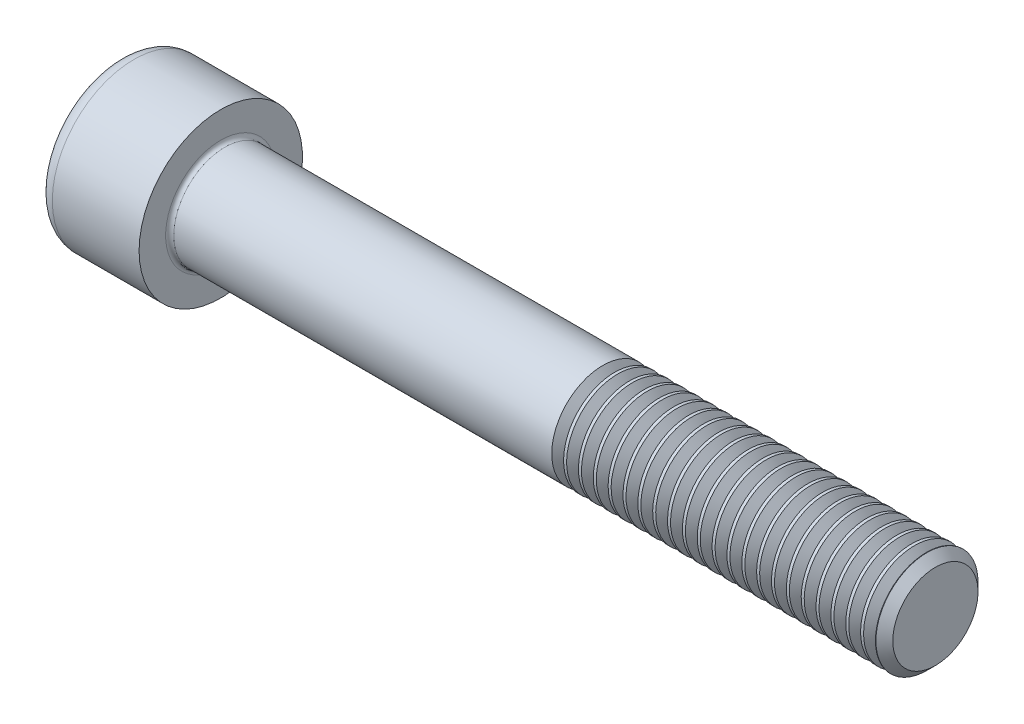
SolidWorks part; units mm, degrees
ref_plane "Plane1" through (0, 0, 0) normal (0, 0, 1) x (1, 0, 0)
ref_plane "Plane2" through (0, 0, 0) normal (0, 1, 0) x (1, 0, 0)
ref_plane "Plane3" through (0, 0, 0) normal (1, 0, 0) x (0, 0, -1)
revolve "Base-Revolve" add sketch "BodySke"
sketch "BodySke" plane through (0, 0, 0) normal (0, 0, 1) x (1, 0, 0)
  line L0 (0, 0) -> (0, 8)
  line L1 (0, 8) -> (10, 8)
  line L2 (10, 8) -> (10, 5)
  line L3 (10, 5) -> (79.172, 5)
  line L4 (80, 4.172) -> (80, 0)
  line L5 (80, 0) -> (0, 0)
  line L6 (-31.75, 0) -> (127, 0) construction
  line L8 (80, 4.172) -> (79.172, 5)
  line L10 (80, -4.172) -> (79.172, -5) construction
  line L11 (11.5, 2.4825) -> (11.5, -3.8675) construction
  line L12 (48, 2.4825) -> (48, -3.8675) construction
  line L13 (20, 2.4825) -> (20, -3.8675) construction
  dimension "Diameter" = 10
  dimension "Head_ht" = 10
  dimension "Length" = 70
  dimension "Body_ch_ang" = 45
  dimension "Head_dia" = 16
  dimension "Minor_dia" = 8.344
  dimension "Advance" = 1.5
  dimension "Thread_nom" = 32
  dimension "Thread_length" = 60
fillet "Fillet1" radius 0.4
fillet "Fillet2" radius 1.5
sketch "Sketch2" plane through (0, 0, 0) normal (0, 0, 1) x (1, 0, 0)
  line L0 (0, 4.0575) -> (5, 4.0575)
  line L1 (5, 4.0575) -> (7.3426, 0)
  line L2 (-31.75, 0) -> (127, 0) construction
  line L3 (7.3426, 0) -> (0, 0)
  line L4 (0, 0) -> (0, 4.0575)
  line L6 (0, 0) -> (47.625, 0) construction
  dimension "D1" = 4.0575
  dimension "D2" = 60
  dimension "Depth" = 5
revolve "Hex-PreBroach" cut sketch "Sketch2" angle 360 about L6
sketch "Sketch3" plane through (0, 0, 0) normal (-1, 0, 0) x (0, 0.5, 0.866)
  line L0 (2.3426, 4.0575) -> (-2.3426, 4.0575)
  line L1 (-2.3426, 4.0575) -> (-4.6852, 0)
  line L2 (2.3426, 4.0575) -> (4.6852, 0)
  line L3 (2.3426, -4.0575) -> (4.6852, 0)
  line L4 (2.3426, -4.0575) -> (-2.3426, -4.0575)
  line L5 (-2.3426, -4.0575) -> (-4.6852, 0)
  dimension "D1" = 4.0575
  dimension "D2" = 4.0575
  dimension "Hex_size" = 8.115
extrude "Hex" cut sketch "Sketch3" against normal blind 5
sketch "ThdSchSke" plane through (0, 0, 0) normal (0, 0, 1) x (1, 0, 0)
  line L0 (48, -4.172) -> (47.4202, -5)
  line L1 (48, -4.172) -> (48.5798, -5)
  line L2 (48.5798, -5) -> (48.5798, -6.25)
  line L3 (-3.175, 0) -> (5.1513, 0) construction
  line L4 (0, 6.5) -> (0, -6.5) construction
  line L5 (48.5798, -6.25) -> (47.4202, -6.25)
  line L6 (47.4202, -6.25) -> (47.4202, -5)
  dimension "Thread_minor" = 8.344
  dimension "Diameter" = 10
  dimension "Start" = 48
  dimension "SideAngle" = 55
  dimension "VeeAngle" = 70
  dimension "Overcut" = 12.5
revolve "ThreadSchematic" cut sketch "ThdSchSke" angle 360 about L3
pattern_linear "ThdSchPat"
equation "\"D2@Sketch3\" = \"Hex_size@Sketch3\" / 2"
equation "\"D1@Sketch3\" = \"Hex_size@Sketch3\" / 2"
equation "\"D1@Sketch2\" = \"Hex_size@Sketch3\" / 2"
equation "\"Thread_minor@ThreadCosmetic\"  =  \"Minor_dia@BodySke\""
equation "\"Depth@Sketch2\" =  \"Key_eng@Hex\""
equation "\"Thread_length@ThreadCosmetic\" = ((sgn( (\"Length@BodySke\" - \"Advance@BodySke\" * 3.0) - \"Thread_nom@BodySke\" )-1)*( (\"Length@BodySke\" - \"Advance@BodySke\" * 3.0) - \"Thread_nom@BodySke\" ))/-2+ \"Thread_no"
equation "\"Thread_minor@ThdSchSke\" = \"Minor_dia@BodySke\""
equation "\"Diameter@ThdSchSke\" = \"Diameter@BodySke\""
equation "\"Overcut@ThdSchSke\" = \"Diameter@BodySke\" * 1.25"
equation "\"Start@ThdSchSke\" = \"Head_ht@BodySke\" + \"Length@BodySke\" - \"Thread_length@ThreadCosmetic\"  '---Non-countersunk---"
equation "\"Num_threads@ThdSchPat\" = int( \"Thread_length@ThreadCosmetic\" / \"Advance@BodySke\" + 0.999 )  + 1"
equation "\"Advance@ThdSchPat\" = \"Thread_length@ThreadCosmetic\" /  (\"Num_threads@ThdSchPat\" - 1) 'relax it"
equation "\"Num_threads@ThdSchPat\" = \"Num_threads@ThdSchPat\" - sgn( \"Num_threads@ThdSchPat\" - 1) '---chamfered tips only---"
